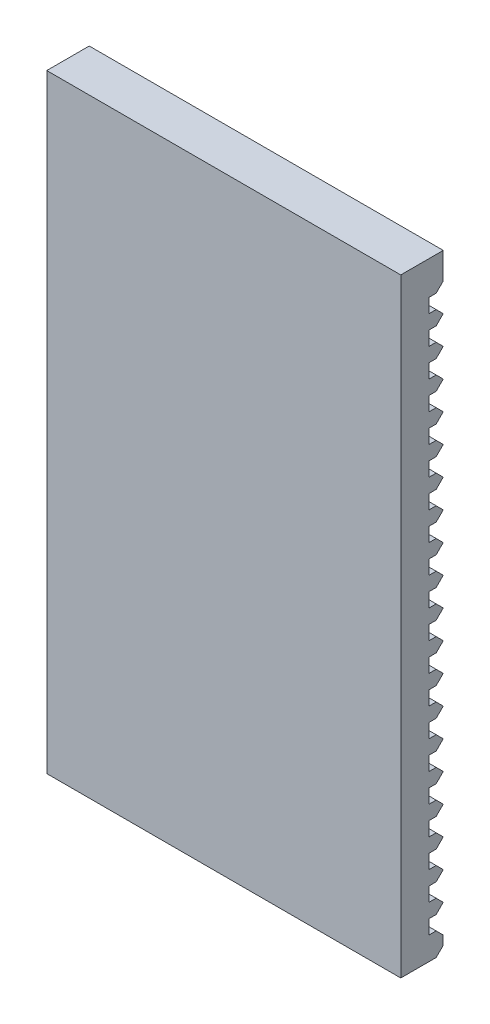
SolidWorks part; units mm, degrees
ref_plane "Plano frontal" through (0, 0, 0) normal (0, 0, 1) x (1, 0, 0)
ref_plane "Plano superior" through (0, 0, 0) normal (0, 1, 0) x (1, 0, 0)
ref_plane "Plano direito" through (0, 0, 0) normal (1, 0, 0) x (0, 0, -1)
sketch "Esboço1" plane through (0, 0, 0) normal (0, 0, 1) x (1, 0, 0)
  line L1 (-5.0145, 1.2968) -> (-2.5145, 1.2968)
  line L2 (-5.0145, 1.2968) -> (-5.0145, -3.0032)
  line L3 (-5.0145, -3.0032) -> (-2.5145, -3.0032)
  line L4 (-2.5145, 1.2968) -> (-2.5145, -3.0032)
  dimension "D1" = 2.5
  dimension "D2" = 4.3
extrude "Ressalto-extrusão1" add sketch "Esboço1" along normal blind 0.3
sketch "Esboço2" plane through (0, 0, 0) normal (0, 0, -1) x (-1, 0, 0)
  line L0 (2.5145, -3.0032) -> (2.5145, 1.2968) construction
  line L1 (2.5145, 0.8599) -> (5.0145, 0.8599)
  line L2 (2.5145, 0.8599) -> (2.5145, 0.7599)
  line L3 (2.5145, 1.0599) -> (5.0145, 1.0599)
  line L4 (2.5145, 1.0599) -> (2.5145, 0.9599)
  line L5 (2.5145, 0.9599) -> (5.0145, 0.9599)
  line L6 (5.0145, 1.0599) -> (5.0145, 0.9599)
  line L7 (5.0145, 1.2968) -> (5.0145, -3.0032) construction
  line L8 (5.0145, 0.8599) -> (5.0145, 0.7599)
  line L9 (2.5145, 0.7599) -> (5.0145, 0.7599)
  line L10 (2.5145, 0.6599) -> (5.0145, 0.6599)
  line L11 (2.5145, 0.6599) -> (2.5145, 0.5599)
  line L12 (5.0145, 0.6599) -> (5.0145, 0.5599)
  line L13 (2.5145, 0.5599) -> (5.0145, 0.5599)
  line L14 (2.5145, 0.4599) -> (5.0145, 0.4599)
  line L15 (2.5145, 0.4599) -> (2.5145, 0.3599)
  line L16 (5.0145, 0.4599) -> (5.0145, 0.3599)
  line L17 (2.5145, 0.3599) -> (5.0145, 0.3599)
  line L18 (2.5145, 0.2599) -> (5.0145, 0.2599)
  line L19 (2.5145, 0.2599) -> (2.5145, 0.1599)
  line L20 (5.0145, 0.2599) -> (5.0145, 0.1599)
  line L21 (2.5145, 0.1599) -> (5.0145, 0.1599)
  line L22 (2.5145, 0.0599) -> (5.0145, 0.0599)
  line L23 (2.5145, 0.0599) -> (2.5145, -0.0401)
  line L24 (5.0145, 0.0599) -> (5.0145, -0.0401)
  line L25 (2.5145, -0.0401) -> (5.0145, -0.0401)
  line L26 (2.5145, -0.1401) -> (5.0145, -0.1401)
  line L27 (2.5145, -0.1401) -> (2.5145, -0.2401)
  line L28 (5.0145, -0.1401) -> (5.0145, -0.2401)
  line L29 (2.5145, -0.2401) -> (5.0145, -0.2401)
  line L30 (2.5145, -0.3401) -> (5.0145, -0.3401)
  line L31 (2.5145, -0.3401) -> (2.5145, -0.4401)
  line L32 (5.0145, -0.3401) -> (5.0145, -0.4401)
  line L33 (2.5145, -0.4401) -> (5.0145, -0.4401)
  line L34 (2.5145, -0.5401) -> (5.0145, -0.5401)
  line L35 (2.5145, -0.5401) -> (2.5145, -0.6401)
  line L36 (5.0145, -0.5401) -> (5.0145, -0.6401)
  line L37 (2.5145, -0.6401) -> (5.0145, -0.6401)
  line L38 (2.5145, -0.7401) -> (5.0145, -0.7401)
  line L39 (2.5145, -0.7401) -> (2.5145, -0.8401)
  line L40 (5.0145, -0.7401) -> (5.0145, -0.8401)
  line L41 (2.5145, -0.8401) -> (5.0145, -0.8401)
  line L42 (2.5145, -0.9401) -> (5.0145, -0.9401)
  line L43 (2.5145, -0.9401) -> (2.5145, -1.0401)
  line L44 (5.0145, -0.9401) -> (5.0145, -1.0401)
  line L45 (2.5145, -1.0401) -> (5.0145, -1.0401)
  line L46 (2.5145, -1.1401) -> (5.0145, -1.1401)
  line L47 (2.5145, -1.1401) -> (2.5145, -1.2401)
  line L48 (5.0145, -1.1401) -> (5.0145, -1.2401)
  line L49 (2.5145, -1.2401) -> (5.0145, -1.2401)
  line L50 (2.5145, -1.3401) -> (5.0145, -1.3401)
  line L51 (2.5145, -1.3401) -> (2.5145, -1.4401)
  line L52 (5.0145, -1.3401) -> (5.0145, -1.4401)
  line L53 (2.5145, -1.4401) -> (5.0145, -1.4401)
  line L54 (2.5145, -1.5401) -> (5.0145, -1.5401)
  line L55 (2.5145, -1.5401) -> (2.5145, -1.6401)
  line L56 (5.0145, -1.5401) -> (5.0145, -1.6401)
  line L57 (2.5145, -1.6401) -> (5.0145, -1.6401)
  line L58 (2.5145, -1.7401) -> (5.0145, -1.7401)
  line L59 (2.5145, -1.7401) -> (2.5145, -1.8401)
  line L60 (5.0145, -1.7401) -> (5.0145, -1.8401)
  line L61 (2.5145, -1.8401) -> (5.0145, -1.8401)
  line L62 (2.5145, -1.9401) -> (5.0145, -1.9401)
  line L63 (2.5145, -1.9401) -> (2.5145, -2.0401)
  line L64 (5.0145, -1.9401) -> (5.0145, -2.0401)
  line L65 (2.5145, -2.0401) -> (5.0145, -2.0401)
  line L66 (2.5145, -2.1401) -> (5.0145, -2.1401)
  line L67 (2.5145, -2.1401) -> (2.5145, -2.2401)
  line L68 (5.0145, -2.1401) -> (5.0145, -2.2401)
  line L69 (2.5145, -2.2401) -> (5.0145, -2.2401)
  line L70 (2.5145, -2.3401) -> (5.0145, -2.3401)
  line L71 (2.5145, -2.3401) -> (2.5145, -2.4401)
  line L72 (5.0145, -2.3401) -> (5.0145, -2.4401)
  line L73 (2.5145, -2.4401) -> (5.0145, -2.4401)
  line L74 (2.5145, -2.5401) -> (5.0145, -2.5401)
  line L75 (2.5145, -2.5401) -> (2.5145, -2.6401)
  line L76 (5.0145, -2.5401) -> (5.0145, -2.6401)
  line L77 (2.5145, -2.6401) -> (5.0145, -2.6401)
  line L78 (2.5145, -2.7401) -> (5.0145, -2.7401)
  line L79 (2.5145, -2.7401) -> (2.5145, -2.8401)
  line L80 (5.0145, -2.7401) -> (5.0145, -2.8401)
  line L81 (2.5145, -2.8401) -> (5.0145, -2.8401)
  dimension "D2" = 20
extrude "Corte-extrusão1" cut sketch "Esboço2" against normal blind 0.1
chamfer "Chanfro1" distance 0.05 angle 45 41 edges at (-3.7645, -3.0032, 0) (-3.7645, -2.8401, 0) (-3.7645, -2.7401, 0) (-3.7645, -2.6401, 0) (-3.7645, -2.5401, 0) (-3.7645, -2.4401, 0) (-3.7645, -2.3401, 0) (-3.7645, -2.2401, 0) (-3.7645, -2.1401, 0) (-3.7645, -2.0401, 0) (-3.7645, -1.9401, 0) (-3.7645, -1.8401, 0) (-3.7645, -1.7401, 0) (-3.7645, -1.6401, 0) (-3.7645, -1.5401, 0) (-3.7645, -1.4401, 0) (-3.7645, -1.3401, 0) (-3.7645, -1.2401, 0) (-3.7645, -1.1401, 0) (-3.7645, -1.0401, 0) (-3.7645, -0.9401, 0) (-3.7645, -0.8401, 0) (-3.7645, -0.7401, 0) (-3.7645, -0.6401, 0) (-3.7645, -0.5401, 0) (-3.7645, -0.4401, 0) (-3.7645, -0.3401, 0) (-3.7645, -0.2401, 0) (-3.7645, -0.1401, 0) (-3.7645, -0.0401, 0) (-3.7645, 0.0599, 0) (-3.7645, 0.1599, 0) (-3.7645, 0.2599, 0) (-3.7645, 0.3599, 0) (-3.7645, 0.4599, 0) (-3.7645, 0.5599, 0) (-3.7645, 0.6599, 0) (-3.7645, 0.7599, 0) (-3.7645, 0.8599, 0) (-3.7645, 0.9599, 0) (-3.7645, 1.0599, 0)
